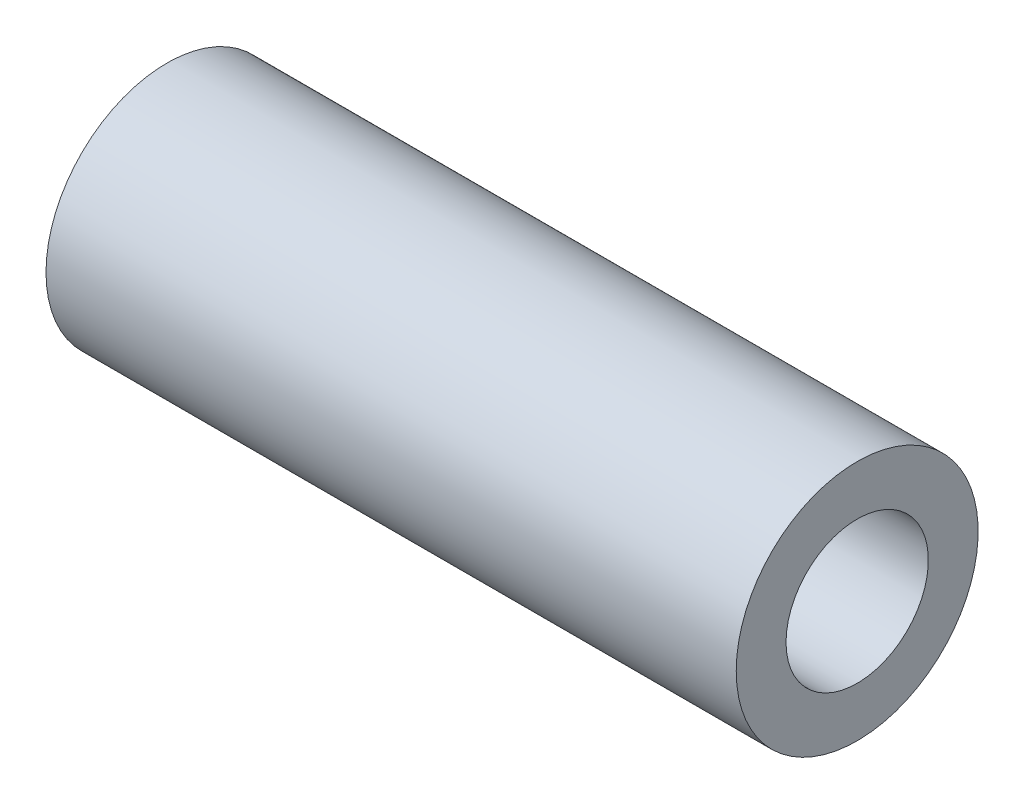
SolidWorks part; units mm, degrees
ref_plane "Piano frontale" through (0, 0, 0) normal (0, 0, 1) x (1, 0, 0)
ref_plane "Piano superiore" through (0, 0, 0) normal (0, 1, 0) x (1, 0, 0)
ref_plane "Piano destro" through (0, 0, 0) normal (1, 0, 0) x (0, 0, -1)
sketch "Schizzo1" plane through (0, 0, 0) normal (0, 0, 1) x (1, 0, 0)
  line L0 (-25.572, 0) -> (33.9161, 0) construction
  line L1 (-18.3802, 5) -> (-18.3802, 8.5)
  line L2 (-18.3802, 8.5) -> (30.1198, 8.5)
  line L3 (30.1198, 8.5) -> (30.1198, 5)
  line L4 (30.1198, 5) -> (-18.3802, 5)
  dimension "D1" = 8.5
  dimension "D2" = 48.5
  dimension "D3" = 5
revolve "Rivoluzione1" add sketch "Schizzo1" angle 360 about L0
